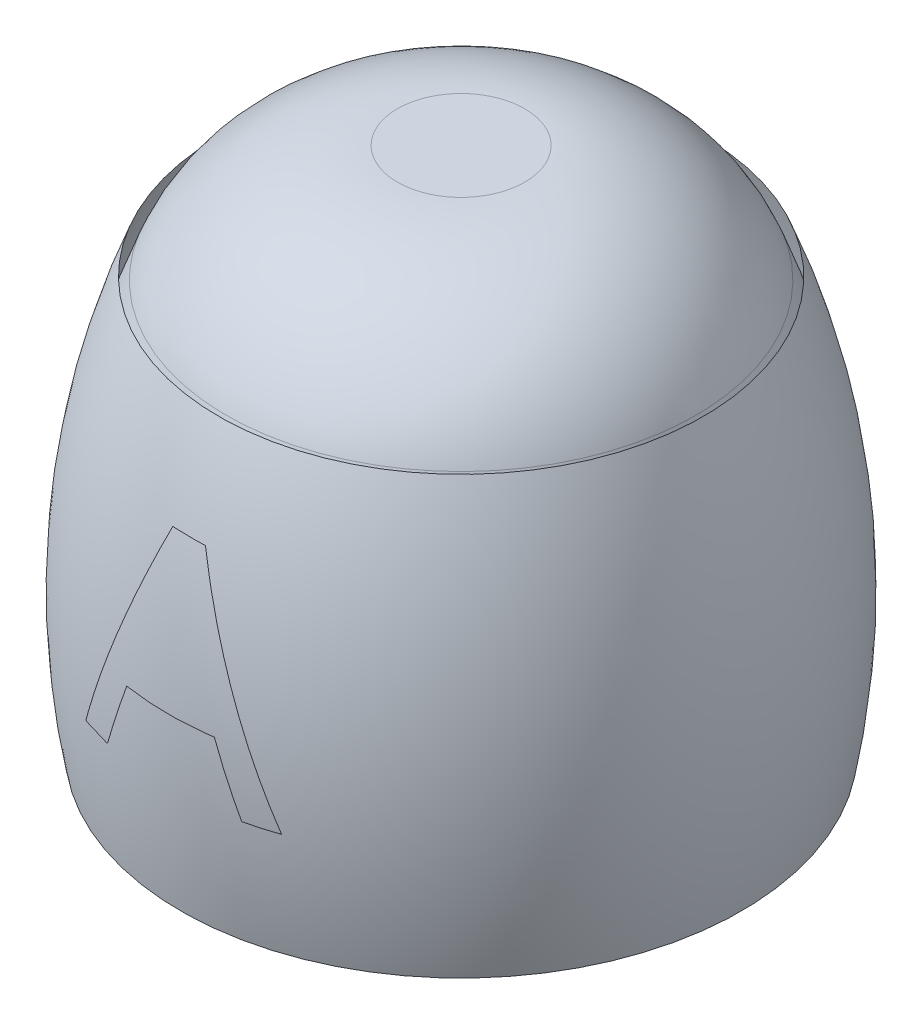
SolidWorks part; units mm, degrees
ref_plane "Front Plane" through (0, 0, 0) normal (0, 0, 1) x (1, 0, 0)
ref_plane "Top Plane" through (0, 0, 0) normal (0, 1, 0) x (1, 0, 0)
ref_plane "Right Plane" through (0, 0, 0) normal (1, 0, 0) x (0, 0, -1)
sketch "Sketch3" plane through (0, 0, 0) normal (0, 0, 1) x (1, 0, 0)
  line L0 (385.524, 64.9627) -> (385.524, -98.5118)
  line L1 (385.524, 64.9627) -> (405.1122, 64.9627)
  line L2 (385.524, -98.5118) -> (471.7802, -98.5118)
  arc A0 (405.1122, 64.9627) -> (460.0961, 27.4884) centre (405.1122, 5.8882) cw
  arc A1 (460.0961, 27.4884) -> (471.7802, -98.5118) centre (248.3704, -55.6869) cw
revolve "Revolve1" add sketch "Sketch3" angle 360 about L0
ref_plane "Plane2" through (0, 0, 96.52) normal (0, 0, 1) x (1, 0, 0)
surface "Surface-Offset2" parameters "D1"=2.54
sketch "Sketch4" plane through (0, 0, 96.52) normal (0, 0, 1) x (1, 0, 0)
  line L0 (295.342, -63.7133) -> (475.706, -63.7133) construction
  arc A0 (310.9519, 27.4884) -> (299.2678, -98.5118) centre (522.6776, -55.6869) ccw construction
  arc A1 (471.7802, -98.5118) -> (460.0961, 27.4884) centre (248.3704, -55.6869) ccw construction
  text T0 "A" font "Arial" height 63.5
extrude "Cut-Extrude1" cut sketch "Sketch4" against normal up to surface (10.1491 mm away)
surface "Surface-Offset3" parameters "D1"=0
